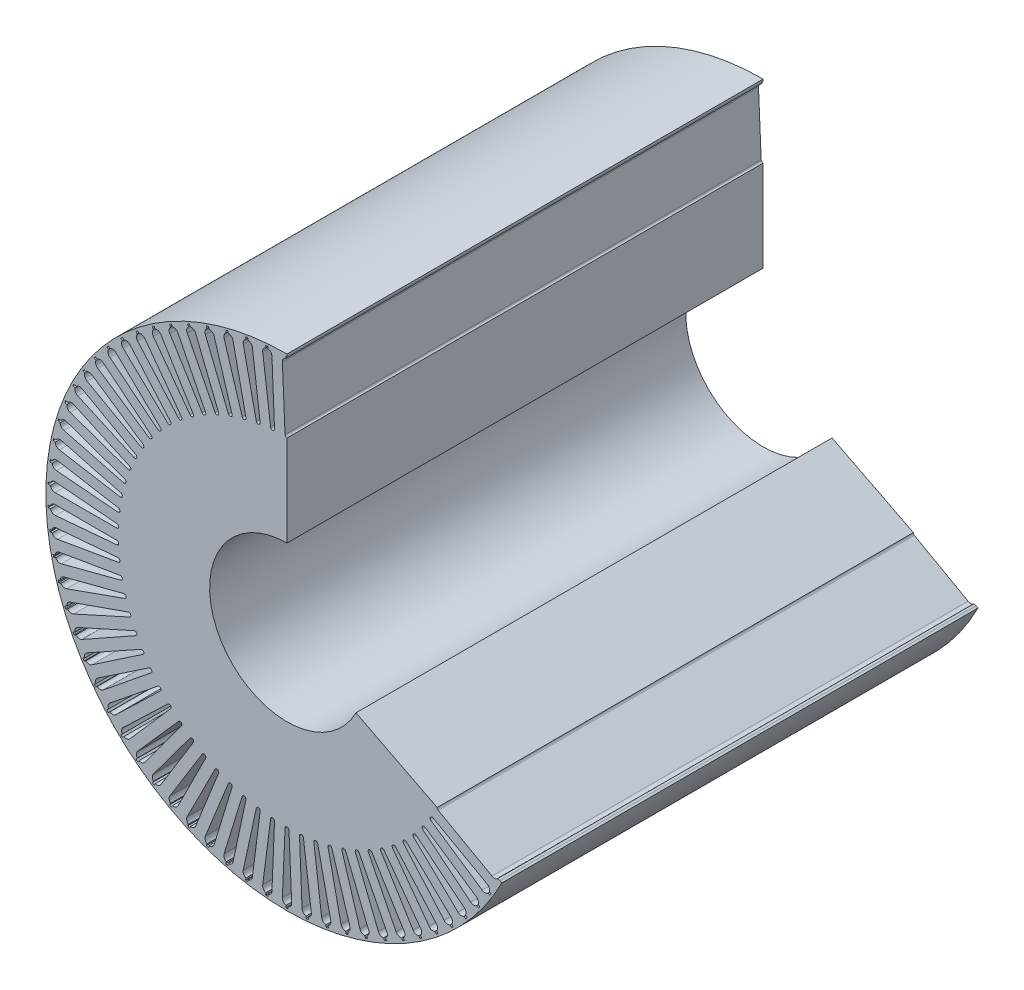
SolidWorks part; units mm, degrees
ref_plane "Přední rovina" through (0, 0, 0) normal (0, 0, 1) x (1, 0, 0)
ref_plane "Horní rovina" through (0, 0, 0) normal (0, 1, 0) x (1, 0, 0)
ref_plane "Pravá rovina" through (0, 0, 0) normal (1, 0, 0) x (0, 0, -1)
sketch "Skica1" plane through (0, 0, 0) normal (0, 0, 1) x (1, 0, 0)
  line L0 (0, 94.0554) -> (0, -97.5291) construction
  line L1 (-111.4898, 0) -> (131.9321, 0) construction
  line L2 (0, 77.9) -> (0, 77.2)
  line L3 (-0.35, 77.2) -> (0.35, 77.2)
  line L4 (0.35, 77.2) -> (0.35, 76.5)
  line L5 (0, 76.5) -> (0, 75.0365)
  line L6 (0, 75.0365) -> (0, 55.0346)
  line L7 (1.5047, 75.0365) -> (0.63, 55.0346)
  line L8 (-1.5047, 75.0365) -> (-0.63, 55.0346)
  line L9 (-0.35, 77.2) -> (-0.35, 76.5)
  line L10 (4.8642, 74.8938) -> (4.0395, 54.8898)
  line L11 (7.8629, 74.6386) -> (5.295, 54.7829)
  line L12 (6.8958, 76.8922) -> (6.8364, 76.1947)
  line L13 (6.1983, 76.9516) -> (6.1389, 76.2541)
  line L14 (6.1983, 76.9516) -> (6.8958, 76.8922)
  line L15 (11.1981, 74.2115) -> (8.68, 54.3495)
  line L16 (14.1643, 73.7029) -> (9.9218, 54.1365)
  line L17 (13.3918, 76.0304) -> (13.2735, 75.3405)
  line L18 (12.7019, 76.1487) -> (12.5836, 75.4588)
  line L19 (12.7019, 76.1487) -> (13.3918, 76.0304)
  line L20 (17.4514, 72.9945) -> (13.2578, 53.4176)
  line L21 (20.3637, 72.2362) -> (14.4772, 53.1001)
  line L22 (19.7914, 74.6208) -> (19.615, 73.9434)
  line L23 (19.114, 74.7972) -> (18.9376, 74.1198)
  line L24 (19.114, 74.7972) -> (19.7914, 74.6208)
  line L25 (23.5789, 71.2515) -> (17.7402, 52.1008)
  line L26 (26.4164, 70.249) -> (18.9282, 51.681)
  line L27 (26.0484, 72.6735) -> (25.8152, 72.0135)
  line L28 (25.3884, 72.9067) -> (25.1552, 72.2467)
  line L29 (25.3884, 72.9067) -> (26.0484, 72.6735)
  line L30 (29.5365, 68.9952) -> (22.0948, 50.4086)
  line L31 (32.2788, 67.7556) -> (23.2429, 49.8896)
  line L32 (32.1177, 70.2027) -> (31.8294, 69.5648)
  line L33 (31.4798, 70.491) -> (31.1915, 69.8531)
  line L34 (31.4798, 70.491) -> (32.1177, 70.2027)
  line L35 (35.2813, 66.2418) -> (26.2901, 48.3533)
  line L36 (37.9086, 64.7741) -> (27.3901, 47.7388)
  line L37 (37.9556, 67.226) -> (37.6142, 66.6149)
  line L38 (37.3445, 67.5674) -> (37.0031, 66.9563)
  line L39 (37.3445, 67.5674) -> (37.9556, 67.226)
  line L40 (40.7719, 63.0111) -> (30.296, 45.9495)
  line L41 (43.2653, 61.3259) -> (31.34, 45.2439)
  line L42 (43.52, 63.765) -> (43.128, 63.185)
  line L43 (42.9401, 64.1569) -> (42.5481, 63.577)
  line L44 (42.9401, 64.1569) -> (43.52, 63.765)
  line L45 (45.9687, 59.3264) -> (34.0837, 43.2147)
  line L46 (48.3102, 57.4358) -> (35.064, 42.4231)
  line L47 (48.7709, 59.8445) -> (48.3311, 59.2999)
  line L48 (48.2263, 60.2842) -> (47.7865, 59.7396)
  line L49 (48.2263, 60.2842) -> (48.7709, 59.8445)
  line L50 (50.8343, 55.2143) -> (37.6258, 40.1685)
  line L51 (53.007, 53.1319) -> (38.5354, 39.2967)
  line L52 (53.6704, 55.4928) -> (53.186, 54.9875)
  line L53 (53.165, 55.9772) -> (52.6806, 55.4718)
  line L54 (53.165, 55.9772) -> (53.6704, 55.4928)
  line L55 (55.3337, 50.7043) -> (40.8967, 36.8329)
  line L56 (57.322, 48.4452) -> (41.7292, 35.8871)
  line L57 (58.1831, 50.7414) -> (57.6577, 50.2789)
  line L58 (57.7207, 51.2668) -> (57.1952, 50.8044)
  line L59 (57.7207, 51.2668) -> (58.1831, 50.7414)
  line L60 (59.4344, 45.829) -> (43.8731, 33.2319)
  line L61 (61.2239, 43.4094) -> (44.6223, 32.2189)
  line L62 (62.2767, 45.6243) -> (61.7139, 45.208)
  line L63 (61.8605, 46.1871) -> (61.2977, 45.7708)
  line L64 (61.8605, 46.1871) -> (62.2767, 45.6243)
  line L65 (63.1068, 40.6235) -> (46.5333, 29.3915)
  line L66 (64.6847, 38.0609) -> (47.1939, 28.3186)
  line L67 (65.9216, 40.1785) -> (65.3255, 39.8115)
  line L68 (65.5545, 40.7746) -> (64.9585, 40.4075)
  line L69 (65.5545, 40.7746) -> (65.9216, 40.1785)
  line L70 (66.3246, 35.1253) -> (48.8582, 25.3393)
  line L71 (67.6795, 32.4381) -> (49.4255, 24.2143)
  line L72 (69.0914, 34.4432) -> (68.4664, 34.1281)
  line L73 (68.7763, 35.0683) -> (68.1513, 34.7531)
  line L74 (68.7763, 35.0683) -> (69.0914, 34.4432)
  line L75 (69.0645, 29.3741) -> (50.8311, 21.1046)
  line L76 (70.1866, 26.5816) -> (51.3009, 19.9354)
  line L77 (71.7635, 28.4598) -> (71.114, 28.1988)
  line L78 (71.5025, 29.1093) -> (70.853, 28.8483)
  line L79 (71.5025, 29.1093) -> (71.7635, 28.4598)
  line L80 (71.3068, 23.4112) -> (52.4378, 16.7178)
  line L81 (72.1881, 20.5336) -> (52.8068, 15.513)
  line L82 (73.9186, 22.2713) -> (73.2492, 22.0663)
  line L83 (73.7136, 22.9406) -> (73.0443, 22.7356)
  line L84 (73.7136, 22.9406) -> (73.9186, 22.2713)
  line L85 (73.0353, 17.2796) -> (53.6667, 12.2105)
  line L86 (73.6694, 14.3377) -> (53.9321, 10.9788)
  line L87 (75.541, 15.9223) -> (74.8567, 15.7748)
  line L88 (75.3935, 16.6066) -> (74.7092, 16.4591)
  line L89 (75.3935, 16.6066) -> (75.541, 15.9223)
  line L90 (74.2376, 11.0235) -> (54.5088, 7.6153)
  line L91 (74.6199, 8.0384) -> (54.6689, 6.3655)
  line L92 (76.6192, 9.4586) -> (75.9248, 9.3697)
  line L93 (76.5303, 10.1529) -> (75.8359, 10.064)
  line L94 (76.5303, 10.1529) -> (76.6192, 9.4586)
  line L95 (74.9051, 4.688) -> (54.9583, 2.9652)
  line L96 (75.0328, 1.6813) -> (55.0118, 1.7063)
  line L97 (77.1453, 2.9268) -> (76.4459, 2.8971)
  line L98 (77.1156, 3.6261) -> (76.4162, 3.5964)
  line L99 (77.1156, 3.6261) -> (77.1453, 2.9268)
  line L100 (75.0328, -1.6813) -> (55.0118, -1.7063)
  line L101 (74.9051, -4.688) -> (54.9583, -2.9652)
  line L102 (77.1156, -3.6261) -> (76.4162, -3.5964)
  line L103 (77.1453, -2.9268) -> (76.4459, -2.8971)
  line L104 (77.1453, -2.9268) -> (77.1156, -3.6261)
  line L105 (74.6199, -8.0384) -> (54.6689, -6.3655)
  line L106 (74.2376, -11.0235) -> (54.5088, -7.6153)
  line L107 (76.5303, -10.1529) -> (75.8359, -10.064)
  line L108 (76.6192, -9.4586) -> (75.9248, -9.3697)
  line L109 (76.6192, -9.4586) -> (76.5303, -10.1529)
  line L110 (73.6694, -14.3377) -> (53.9321, -10.9788)
  line L111 (73.0353, -17.2796) -> (53.6667, -12.2105)
  line L112 (75.3935, -16.6066) -> (74.7092, -16.4591)
  line L113 (75.541, -15.9223) -> (74.8567, -15.7748)
  line L114 (75.541, -15.9223) -> (75.3935, -16.6066)
  line L115 (72.1881, -20.5336) -> (52.8068, -15.513)
  line L116 (71.3068, -23.4112) -> (52.4378, -16.7178)
  line L117 (73.7136, -22.9406) -> (73.0443, -22.7356)
  line L118 (73.9186, -22.2713) -> (73.2492, -22.0663)
  line L119 (73.9186, -22.2713) -> (73.7136, -22.9406)
  line L120 (70.1866, -26.5816) -> (51.3009, -19.9354)
  line L121 (69.0645, -29.3741) -> (50.8311, -21.1046)
  line L122 (71.5025, -29.1093) -> (70.853, -28.8483)
  line L123 (71.7635, -28.4598) -> (71.114, -28.1988)
  line L124 (71.7635, -28.4598) -> (71.5025, -29.1093)
  line L125 (67.6795, -32.4381) -> (49.4255, -24.2143)
  line L126 (66.3246, -35.1253) -> (48.8582, -25.3393)
  line L127 (68.7763, -35.0683) -> (68.1513, -34.7531)
  line L128 (69.0914, -34.4432) -> (68.4664, -34.1281)
  line L129 (69.0914, -34.4432) -> (68.7763, -35.0683)
  line L130 (64.6847, -38.0609) -> (47.1939, -28.3186)
  line L131 (63.1068, -40.6235) -> (46.5333, -29.3915)
  line L132 (65.5545, -40.7746) -> (64.9585, -40.4075)
  line L133 (65.9216, -40.1785) -> (65.3255, -39.8115)
  line L134 (65.9216, -40.1785) -> (65.5545, -40.7746)
  line L135 (61.2239, -43.4094) -> (44.6223, -32.2189)
  line L136 (59.4344, -45.829) -> (43.8731, -33.2319)
  line L137 (61.8605, -46.1871) -> (61.2977, -45.7708)
  line L138 (62.2767, -45.6243) -> (61.7139, -45.208)
  line L139 (62.2767, -45.6243) -> (61.8605, -46.1871)
  line L140 (57.322, -48.4452) -> (41.7292, -35.8871)
  line L141 (55.3337, -50.7043) -> (40.8967, -36.8329)
  line L142 (57.7207, -51.2668) -> (57.1952, -50.8044)
  line L143 (58.1831, -50.7414) -> (57.6577, -50.2789)
  line L144 (58.1831, -50.7414) -> (57.7207, -51.2668)
  line L145 (53.007, -53.1319) -> (38.5354, -39.2967)
  line L146 (50.8343, -55.2143) -> (37.6258, -40.1685)
  line L147 (53.165, -55.9772) -> (52.6806, -55.4718)
  line L148 (53.6704, -55.4928) -> (53.186, -54.9875)
  line L149 (53.6704, -55.4928) -> (53.165, -55.9772)
  line L150 (48.3102, -57.4358) -> (35.064, -42.4231)
  line L151 (45.9687, -59.3264) -> (34.0837, -43.2147)
  line L152 (48.2263, -60.2842) -> (47.7865, -59.7396)
  line L153 (48.7709, -59.8445) -> (48.3311, -59.2999)
  line L154 (48.7709, -59.8445) -> (48.2263, -60.2842)
  line L155 (43.2653, -61.3259) -> (31.34, -45.2439)
  line L156 (40.7719, -63.0111) -> (30.296, -45.9495)
  line L157 (42.9401, -64.1569) -> (42.5481, -63.577)
  line L158 (43.52, -63.765) -> (43.128, -63.185)
  line L159 (43.52, -63.765) -> (42.9401, -64.1569)
  line L160 (37.9086, -64.7741) -> (27.3901, -47.7388)
  line L161 (35.2813, -66.2418) -> (26.2901, -48.3533)
  line L162 (37.3445, -67.5674) -> (37.0031, -66.9563)
  line L163 (37.9556, -67.226) -> (37.6142, -66.6149)
  line L164 (37.9556, -67.226) -> (37.3445, -67.5674)
  line L165 (32.2788, -67.7556) -> (23.2429, -49.8896)
  line L166 (29.5365, -68.9952) -> (22.0948, -50.4086)
  line L167 (31.4798, -70.491) -> (31.1915, -69.8531)
  line L168 (32.1177, -70.2027) -> (31.8294, -69.5648)
  line L169 (32.1177, -70.2027) -> (31.4798, -70.491)
  line L170 (26.4164, -70.249) -> (18.9282, -51.681)
  line L171 (23.5789, -71.2515) -> (17.7402, -52.1008)
  line L172 (25.3884, -72.9067) -> (25.1552, -72.2467)
  line L173 (26.0484, -72.6735) -> (25.8152, -72.0135)
  line L174 (26.0484, -72.6735) -> (25.3884, -72.9067)
  line L175 (20.3637, -72.2362) -> (14.4772, -53.1001)
  line L176 (17.4514, -72.9945) -> (13.2578, -53.4176)
  line L177 (19.114, -74.7972) -> (18.9376, -74.1198)
  line L178 (19.7914, -74.6208) -> (19.615, -73.9434)
  line L179 (19.7914, -74.6208) -> (19.114, -74.7972)
  line L180 (14.1643, -73.7029) -> (9.9218, -54.1365)
  line L181 (11.1981, -74.2115) -> (8.68, -54.3495)
  line L182 (12.7019, -76.1487) -> (12.5836, -75.4588)
  line L183 (13.3918, -76.0304) -> (13.2735, -75.3405)
  line L184 (13.3918, -76.0304) -> (12.7019, -76.1487)
  line L185 (7.8629, -74.6386) -> (5.295, -54.7829)
  line L186 (4.8642, -74.8938) -> (4.0395, -54.8898)
  line L187 (6.1983, -76.9516) -> (6.1389, -76.2541)
  line L188 (6.8958, -76.8922) -> (6.8364, -76.1947)
  line L189 (6.8958, -76.8922) -> (6.1983, -76.9516)
  line L190 (1.5047, -75.0365) -> (0.63, -55.0346)
  line L191 (-1.5047, -75.0365) -> (-0.63, -55.0346)
  line L192 (-0.35, -77.2) -> (-0.35, -76.5)
  line L193 (0.35, -77.2) -> (0.35, -76.5)
  line L194 (0.35, -77.2) -> (-0.35, -77.2)
  line L195 (-4.8642, -74.8938) -> (-4.0395, -54.8898)
  line L196 (-7.8629, -74.6386) -> (-5.295, -54.7829)
  line L197 (-6.8958, -76.8922) -> (-6.8364, -76.1947)
  line L198 (-6.1983, -76.9516) -> (-6.1389, -76.2541)
  line L199 (-6.1983, -76.9516) -> (-6.8958, -76.8922)
  line L200 (-11.1981, -74.2115) -> (-8.68, -54.3495)
  line L201 (-14.1643, -73.7029) -> (-9.9218, -54.1365)
  line L202 (-13.3918, -76.0304) -> (-13.2735, -75.3405)
  line L203 (-12.7019, -76.1487) -> (-12.5836, -75.4588)
  line L204 (-12.7019, -76.1487) -> (-13.3918, -76.0304)
  line L205 (-17.4514, -72.9945) -> (-13.2578, -53.4176)
  line L206 (-20.3637, -72.2362) -> (-14.4772, -53.1001)
  line L207 (-19.7914, -74.6208) -> (-19.615, -73.9434)
  line L208 (-19.114, -74.7972) -> (-18.9376, -74.1198)
  line L209 (-19.114, -74.7972) -> (-19.7914, -74.6208)
  line L210 (-23.5789, -71.2515) -> (-17.7402, -52.1008)
  line L211 (-26.4164, -70.249) -> (-18.9282, -51.681)
  line L212 (-26.0484, -72.6735) -> (-25.8152, -72.0135)
  line L213 (-25.3884, -72.9067) -> (-25.1552, -72.2467)
  line L214 (-25.3884, -72.9067) -> (-26.0484, -72.6735)
  line L215 (-29.5365, -68.9952) -> (-22.0948, -50.4086)
  line L216 (-32.2788, -67.7556) -> (-23.2429, -49.8896)
  line L217 (-32.1177, -70.2027) -> (-31.8294, -69.5648)
  line L218 (-31.4798, -70.491) -> (-31.1915, -69.8531)
  line L219 (-31.4798, -70.491) -> (-32.1177, -70.2027)
  line L220 (-35.2813, -66.2418) -> (-26.2901, -48.3533)
  line L221 (-37.9086, -64.7741) -> (-27.3901, -47.7388)
  line L222 (-37.9556, -67.226) -> (-37.6142, -66.6149)
  line L223 (-37.3445, -67.5674) -> (-37.0031, -66.9563)
  line L224 (-37.3445, -67.5674) -> (-37.9556, -67.226)
  line L225 (-40.7719, -63.0111) -> (-30.296, -45.9495)
  line L226 (-43.2653, -61.3259) -> (-31.34, -45.2439)
  line L227 (-43.52, -63.765) -> (-43.128, -63.185)
  line L228 (-42.9401, -64.1569) -> (-42.5481, -63.577)
  line L229 (-42.9401, -64.1569) -> (-43.52, -63.765)
  line L230 (-45.9687, -59.3264) -> (-34.0837, -43.2147)
  line L231 (-48.3102, -57.4358) -> (-35.064, -42.4231)
  line L232 (-48.7709, -59.8445) -> (-48.3311, -59.2999)
  line L233 (-48.2263, -60.2842) -> (-47.7865, -59.7396)
  line L234 (-48.2263, -60.2842) -> (-48.7709, -59.8445)
  line L235 (-50.8343, -55.2143) -> (-37.6258, -40.1685)
  line L236 (-53.007, -53.1319) -> (-38.5354, -39.2967)
  line L237 (-53.6704, -55.4928) -> (-53.186, -54.9875)
  line L238 (-53.165, -55.9772) -> (-52.6806, -55.4718)
  line L239 (-53.165, -55.9772) -> (-53.6704, -55.4928)
  line L240 (-55.3337, -50.7043) -> (-40.8967, -36.8329)
  line L241 (-57.322, -48.4452) -> (-41.7292, -35.8871)
  line L242 (-58.1831, -50.7414) -> (-57.6577, -50.2789)
  line L243 (-57.7207, -51.2668) -> (-57.1952, -50.8044)
  line L244 (-57.7207, -51.2668) -> (-58.1831, -50.7414)
  line L245 (-59.4344, -45.829) -> (-43.8731, -33.2319)
  line L246 (-61.2239, -43.4094) -> (-44.6223, -32.2189)
  line L247 (-62.2767, -45.6243) -> (-61.7139, -45.208)
  line L248 (-61.8605, -46.1871) -> (-61.2977, -45.7708)
  line L249 (-61.8605, -46.1871) -> (-62.2767, -45.6243)
  line L250 (-63.1068, -40.6235) -> (-46.5333, -29.3915)
  line L251 (-64.6847, -38.0609) -> (-47.1939, -28.3186)
  line L252 (-65.9216, -40.1785) -> (-65.3255, -39.8115)
  line L253 (-65.5545, -40.7746) -> (-64.9585, -40.4075)
  line L254 (-65.5545, -40.7746) -> (-65.9216, -40.1785)
  line L255 (-66.3246, -35.1253) -> (-48.8582, -25.3393)
  line L256 (-67.6795, -32.4381) -> (-49.4255, -24.2143)
  line L257 (-69.0914, -34.4432) -> (-68.4664, -34.1281)
  line L258 (-68.7763, -35.0683) -> (-68.1513, -34.7531)
  line L259 (-68.7763, -35.0683) -> (-69.0914, -34.4432)
  line L260 (-69.0645, -29.3741) -> (-50.8311, -21.1046)
  line L261 (-70.1866, -26.5816) -> (-51.3009, -19.9354)
  line L262 (-71.7635, -28.4598) -> (-71.114, -28.1988)
  line L263 (-71.5025, -29.1093) -> (-70.853, -28.8483)
  line L264 (-71.5025, -29.1093) -> (-71.7635, -28.4598)
  line L265 (-71.3068, -23.4112) -> (-52.4378, -16.7178)
  line L266 (-72.1881, -20.5336) -> (-52.8068, -15.513)
  line L267 (-73.9186, -22.2713) -> (-73.2492, -22.0663)
  line L268 (-73.7136, -22.9406) -> (-73.0443, -22.7356)
  line L269 (-73.7136, -22.9406) -> (-73.9186, -22.2713)
  line L270 (-73.0353, -17.2796) -> (-53.6667, -12.2105)
  line L271 (-73.6694, -14.3377) -> (-53.9321, -10.9788)
  line L272 (-75.541, -15.9223) -> (-74.8567, -15.7748)
  line L273 (-75.3935, -16.6066) -> (-74.7092, -16.4591)
  line L274 (-75.3935, -16.6066) -> (-75.541, -15.9223)
  line L275 (-74.2376, -11.0235) -> (-54.5088, -7.6153)
  line L276 (-74.6199, -8.0384) -> (-54.6689, -6.3655)
  line L277 (-76.6192, -9.4586) -> (-75.9248, -9.3697)
  line L278 (-76.5303, -10.1529) -> (-75.8359, -10.064)
  line L279 (-76.5303, -10.1529) -> (-76.6192, -9.4586)
  line L280 (-74.9051, -4.688) -> (-54.9583, -2.9652)
  line L281 (-75.0328, -1.6813) -> (-55.0118, -1.7063)
  line L282 (-77.1453, -2.9268) -> (-76.4459, -2.8971)
  line L283 (-77.1156, -3.6261) -> (-76.4162, -3.5964)
  line L284 (-77.1156, -3.6261) -> (-77.1453, -2.9268)
  line L285 (-75.0328, 1.6813) -> (-55.0118, 1.7063)
  line L286 (-74.9051, 4.688) -> (-54.9583, 2.9652)
  line L287 (-77.1156, 3.6261) -> (-76.4162, 3.5964)
  line L288 (-77.1453, 2.9268) -> (-76.4459, 2.8971)
  line L289 (-77.1453, 2.9268) -> (-77.1156, 3.6261)
  line L290 (-74.6199, 8.0384) -> (-54.6689, 6.3655)
  line L291 (-74.2376, 11.0235) -> (-54.5088, 7.6153)
  line L292 (-76.5303, 10.1529) -> (-75.8359, 10.064)
  line L293 (-76.6192, 9.4586) -> (-75.9248, 9.3697)
  line L294 (-76.6192, 9.4586) -> (-76.5303, 10.1529)
  line L295 (-73.6694, 14.3377) -> (-53.9321, 10.9788)
  line L296 (-73.0353, 17.2796) -> (-53.6667, 12.2105)
  line L297 (-75.3935, 16.6066) -> (-74.7092, 16.4591)
  line L298 (-75.541, 15.9223) -> (-74.8567, 15.7748)
  line L299 (-75.541, 15.9223) -> (-75.3935, 16.6066)
  line L300 (-72.1881, 20.5336) -> (-52.8068, 15.513)
  line L301 (-71.3068, 23.4112) -> (-52.4378, 16.7178)
  line L302 (-73.7136, 22.9406) -> (-73.0443, 22.7356)
  line L303 (-73.9186, 22.2713) -> (-73.2492, 22.0663)
  line L304 (-73.9186, 22.2713) -> (-73.7136, 22.9406)
  line L305 (-70.1866, 26.5816) -> (-51.3009, 19.9354)
  line L306 (-69.0645, 29.3741) -> (-50.8311, 21.1046)
  line L307 (-71.5025, 29.1093) -> (-70.853, 28.8483)
  line L308 (-71.7635, 28.4598) -> (-71.114, 28.1988)
  line L309 (-71.7635, 28.4598) -> (-71.5025, 29.1093)
  line L310 (-67.6795, 32.4381) -> (-49.4255, 24.2143)
  line L311 (-66.3246, 35.1253) -> (-48.8582, 25.3393)
  line L312 (-68.7763, 35.0683) -> (-68.1513, 34.7531)
  line L313 (-69.0914, 34.4432) -> (-68.4664, 34.1281)
  line L314 (-69.0914, 34.4432) -> (-68.7763, 35.0683)
  line L315 (-64.6847, 38.0609) -> (-47.1939, 28.3186)
  line L316 (-63.1068, 40.6235) -> (-46.5333, 29.3915)
  line L317 (-65.5545, 40.7746) -> (-64.9585, 40.4075)
  line L318 (-65.9216, 40.1785) -> (-65.3255, 39.8115)
  line L319 (-65.9216, 40.1785) -> (-65.5545, 40.7746)
  line L320 (-61.2239, 43.4094) -> (-44.6223, 32.2189)
  line L321 (-59.4344, 45.829) -> (-43.8731, 33.2319)
  line L322 (-61.8605, 46.1871) -> (-61.2977, 45.7708)
  line L323 (-62.2767, 45.6243) -> (-61.7139, 45.208)
  line L324 (-62.2767, 45.6243) -> (-61.8605, 46.1871)
  line L325 (-57.322, 48.4452) -> (-41.7292, 35.8871)
  line L326 (-55.3337, 50.7043) -> (-40.8967, 36.8329)
  line L327 (-57.7207, 51.2668) -> (-57.1952, 50.8044)
  line L328 (-58.1831, 50.7414) -> (-57.6577, 50.2789)
  line L329 (-58.1831, 50.7414) -> (-57.7207, 51.2668)
  line L330 (-53.007, 53.1319) -> (-38.5354, 39.2967)
  line L331 (-50.8343, 55.2143) -> (-37.6258, 40.1685)
  line L332 (-53.165, 55.9772) -> (-52.6806, 55.4718)
  line L333 (-53.6704, 55.4928) -> (-53.186, 54.9875)
  line L334 (-53.6704, 55.4928) -> (-53.165, 55.9772)
  line L335 (-48.3102, 57.4358) -> (-35.064, 42.4231)
  line L336 (-45.9687, 59.3264) -> (-34.0837, 43.2147)
  line L337 (-48.2263, 60.2842) -> (-47.7865, 59.7396)
  line L338 (-48.7709, 59.8445) -> (-48.3311, 59.2999)
  line L339 (-48.7709, 59.8445) -> (-48.2263, 60.2842)
  line L340 (-43.2653, 61.3259) -> (-31.34, 45.2439)
  line L341 (-40.7719, 63.0111) -> (-30.296, 45.9495)
  line L342 (-42.9401, 64.1569) -> (-42.5481, 63.577)
  line L343 (-43.52, 63.765) -> (-43.128, 63.185)
  line L344 (-43.52, 63.765) -> (-42.9401, 64.1569)
  line L345 (-37.9086, 64.7741) -> (-27.3901, 47.7388)
  line L346 (-35.2813, 66.2418) -> (-26.2901, 48.3533)
  line L347 (-37.3445, 67.5674) -> (-37.0031, 66.9563)
  line L348 (-37.9556, 67.226) -> (-37.6142, 66.6149)
  line L349 (-37.9556, 67.226) -> (-37.3445, 67.5674)
  line L350 (-32.2788, 67.7556) -> (-23.2429, 49.8896)
  line L351 (-29.5365, 68.9952) -> (-22.0948, 50.4086)
  line L352 (-31.4798, 70.491) -> (-31.1915, 69.8531)
  line L353 (-32.1177, 70.2027) -> (-31.8294, 69.5648)
  line L354 (-32.1177, 70.2027) -> (-31.4798, 70.491)
  line L355 (-26.4164, 70.249) -> (-18.9282, 51.681)
  line L356 (-23.5789, 71.2515) -> (-17.7402, 52.1008)
  line L357 (-25.3884, 72.9067) -> (-25.1552, 72.2467)
  line L358 (-26.0484, 72.6735) -> (-25.8152, 72.0135)
  line L359 (-26.0484, 72.6735) -> (-25.3884, 72.9067)
  line L360 (-20.3637, 72.2362) -> (-14.4772, 53.1001)
  line L361 (-17.4514, 72.9945) -> (-13.2578, 53.4176)
  line L362 (-19.114, 74.7972) -> (-18.9376, 74.1198)
  line L363 (-19.7914, 74.6208) -> (-19.615, 73.9434)
  line L364 (-19.7914, 74.6208) -> (-19.114, 74.7972)
  line L365 (-14.1643, 73.7029) -> (-9.9218, 54.1365)
  line L366 (-11.1981, 74.2115) -> (-8.68, 54.3495)
  line L367 (-12.7019, 76.1487) -> (-12.5836, 75.4588)
  line L368 (-13.3918, 76.0304) -> (-13.2735, 75.3405)
  line L369 (-13.3918, 76.0304) -> (-12.7019, 76.1487)
  line L370 (-7.8629, 74.6386) -> (-5.295, 54.7829)
  line L371 (-4.8642, 74.8938) -> (-4.0395, 54.8898)
  line L372 (-6.1983, 76.9516) -> (-6.1389, 76.2541)
  line L373 (-6.8958, 76.8922) -> (-6.8364, 76.1947)
  line L374 (-6.8958, 76.8922) -> (-6.1983, 76.9516)
  circle A0 centre (0, 0) radius 25
  circle A1 centre (0, 0) radius 77.9
  arc A2 (1.499, 74.9052) -> (0.35, 76.5) centre (0, 75.0365) ccw
  arc A3 (-0.63, 55.0346) -> (0.63, 55.0346) centre (0, 55.0346) ccw
  arc A4 (-0.35, 76.5) -> (-1.499, 74.9052) centre (0, 75.0365) ccw
  arc A5 (4.0395, 54.8898) -> (5.295, 54.7829) centre (4.6673, 54.8364) ccw
  arc A6 (6.1389, 76.2541) -> (4.8588, 74.7624) centre (6.3635, 74.7662) ccw
  arc A7 (7.846, 74.5082) -> (6.8364, 76.1947) centre (6.3635, 74.7662) ccw
  arc A8 (8.68, 54.3495) -> (9.9218, 54.1365) centre (9.3009, 54.243) ccw
  arc A9 (12.5836, 75.4588) -> (11.1816, 74.0811) centre (12.6812, 73.9572) ccw
  arc A10 (14.1365, 73.5744) -> (13.2735, 75.3405) centre (12.6812, 73.9572) ccw
  arc A11 (13.2578, 53.4176) -> (14.4772, 53.1001) centre (13.8675, 53.2588) ccw
  arc A12 (18.9376, 74.1198) -> (17.4238, 72.8659) centre (18.9076, 72.6153) ccw
  arc A13 (20.3251, 72.1105) -> (19.615, 73.9434) centre (18.9076, 72.6153) ccw
  arc A14 (17.7402, 52.1008) -> (18.9282, 51.681) centre (18.3342, 51.8909) ccw
  arc A15 (25.1552, 72.2467) -> (23.5405, 71.1258) centre (24.9977, 70.7503) ccw
  arc A16 (26.3673, 70.127) -> (25.8152, 72.0135) centre (24.9977, 70.7503) ccw
  arc A17 (22.0948, 50.4086) -> (23.2429, 49.8896) centre (22.6688, 50.1491) ccw
  arc A18 (31.1915, 69.8531) -> (29.4876, 68.8732) centre (30.9076, 68.3754) ccw
  arc A19 (32.2195, 67.6383) -> (31.8294, 69.5648) centre (30.9076, 68.3754) ccw
  arc A20 (26.2901, 48.3533) -> (27.3901, 47.7388) centre (26.8401, 48.046) ccw
  arc A21 (37.0031, 66.9563) -> (35.2222, 66.1243) centre (36.5949, 65.508) ccw
  arc A22 (37.8395, 64.6622) -> (37.6142, 66.6149) centre (36.5949, 65.508) ccw
  arc A23 (30.296, 45.9495) -> (31.34, 45.2439) centre (30.818, 45.5967) ccw
  arc A24 (42.5481, 63.577) -> (40.7031, 62.8991) centre (42.0186, 62.1685) ccw
  arc A25 (43.1869, 61.2203) -> (43.128, 63.185) centre (42.0186, 62.1685) ccw
  arc A26 (34.0837, 43.2147) -> (35.064, 42.4231) centre (34.5739, 42.8189) ccw
  arc A27 (47.7865, 59.7396) -> (45.8907, 59.2206) centre (47.1394, 58.3811) ccw
  arc A28 (48.2232, 57.3372) -> (48.3311, 59.2999) centre (47.1394, 58.3811) ccw
  arc A29 (37.6258, 40.1685) -> (38.5354, 39.2967) centre (38.0806, 39.7326) ccw
  arc A30 (52.6806, 55.4718) -> (50.7476, 55.1155) centre (51.9207, 54.1731) ccw
  arc A31 (52.912, 53.041) -> (53.186, 54.9875) centre (51.9207, 54.1731) ccw
  arc A32 (40.8967, 36.8329) -> (41.7292, 35.8871) centre (41.313, 36.36) ccw
  arc A33 (57.1952, 50.8044) -> (55.2389, 50.6132) centre (56.3278, 49.5747) ccw
  arc A34 (57.2196, 48.3627) -> (57.6577, 50.2789) centre (56.3278, 49.5747) ccw
  arc A35 (43.8731, 33.2319) -> (44.6223, 32.2189) centre (44.2477, 32.7254) ccw
  arc A36 (61.2977, 45.7708) -> (59.3322, 45.7463) centre (60.3292, 44.6192) ccw
  arc A37 (61.1149, 43.3359) -> (61.7139, 45.208) centre (60.3292, 44.6192) ccw
  arc A38 (46.5333, 29.3915) -> (47.1939, 28.3186) centre (46.8636, 28.8551) ccw
  arc A39 (64.9585, 40.4075) -> (62.998, 40.5498) centre (63.8958, 39.3422) ccw
  arc A40 (64.5699, 37.9969) -> (65.3255, 39.8115) centre (63.8958, 39.3422) ccw
  arc A41 (48.8582, 25.3393) -> (49.4255, 24.2143) centre (49.1418, 24.7768) ccw
  arc A42 (68.1513, 34.7531) -> (66.2099, 35.0611) centre (67.0021, 33.7817) ccw
  arc A43 (67.5596, 32.3841) -> (68.4664, 34.1281) centre (67.0021, 33.7817) ccw
  arc A44 (50.8311, 21.1046) -> (51.3009, 19.9354) centre (51.066, 20.52) ccw
  arc A45 (70.853, 28.8483) -> (68.9448, 29.3198) centre (69.6256, 27.9779) ccw
  arc A46 (70.0626, 26.538) -> (71.114, 28.1988) centre (69.6256, 27.9779) ccw
  arc A47 (52.4378, 16.7178) -> (52.8068, 15.513) centre (52.6223, 16.1154) ccw
  arc A48 (73.0443, 22.7356) -> (71.1829, 23.3672) centre (71.7474, 21.9724) ccw
  arc A49 (72.0608, 20.5007) -> (73.2492, 22.0663) centre (71.7474, 21.9724) ccw
  arc A50 (53.6667, 12.2105) -> (53.9321, 10.9788) centre (53.7994, 11.5947) ccw
  arc A51 (74.7092, 16.4591) -> (72.9081, 17.2463) centre (73.3524, 15.8086) ccw
  arc A52 (73.5397, 14.3156) -> (74.8567, 15.7748) centre (73.3524, 15.8086) ccw
  arc A53 (54.5088, 7.6153) -> (54.6689, 6.3655) centre (54.5889, 6.9904) ccw
  arc A54 (75.8359, 10.064) -> (74.1081, 11.0011) centre (74.4288, 9.531) ccw
  arc A55 (74.4889, 8.0274) -> (75.9248, 9.3697) centre (74.4288, 9.531) ccw
  arc A56 (54.9583, 2.9652) -> (55.0118, 1.7063) centre (54.985, 2.3357) ccw
  arc A57 (76.4162, 3.5964) -> (74.7741, 4.6767) centre (74.9689, 3.1846) ccw
  arc A58 (74.9013, 1.6814) -> (76.4459, 2.8971) centre (74.9689, 3.1846) ccw
  arc A59 (55.0118, -1.7063) -> (54.9583, -2.9652) centre (54.985, -2.3357) ccw
  arc A60 (76.4459, -2.8971) -> (74.9013, -1.6814) centre (74.9689, -3.1846) ccw
  arc A61 (74.7741, -4.6767) -> (76.4162, -3.5964) centre (74.9689, -3.1846) ccw
  arc A62 (54.6689, -6.3655) -> (54.5088, -7.6153) centre (54.5889, -6.9904) ccw
  arc A63 (75.9248, -9.3697) -> (74.4889, -8.0274) centre (74.4288, -9.531) ccw
  arc A64 (74.1081, -11.0011) -> (75.8359, -10.064) centre (74.4288, -9.531) ccw
  arc A65 (53.9321, -10.9788) -> (53.6667, -12.2105) centre (53.7994, -11.5947) ccw
  arc A66 (74.8567, -15.7748) -> (73.5397, -14.3156) centre (73.3524, -15.8086) ccw
  arc A67 (72.9081, -17.2463) -> (74.7092, -16.4591) centre (73.3524, -15.8086) ccw
  arc A68 (52.8068, -15.513) -> (52.4378, -16.7178) centre (52.6223, -16.1154) ccw
  arc A69 (73.2492, -22.0663) -> (72.0608, -20.5007) centre (71.7474, -21.9724) ccw
  arc A70 (71.1829, -23.3672) -> (73.0443, -22.7356) centre (71.7474, -21.9724) ccw
  arc A71 (51.3009, -19.9354) -> (50.8311, -21.1046) centre (51.066, -20.52) ccw
  arc A72 (71.114, -28.1988) -> (70.0626, -26.538) centre (69.6256, -27.9779) ccw
  arc A73 (68.9448, -29.3198) -> (70.853, -28.8483) centre (69.6256, -27.9779) ccw
  arc A74 (49.4255, -24.2143) -> (48.8582, -25.3393) centre (49.1418, -24.7768) ccw
  arc A75 (68.4664, -34.1281) -> (67.5596, -32.3841) centre (67.0021, -33.7817) ccw
  arc A76 (66.2099, -35.0611) -> (68.1513, -34.7531) centre (67.0021, -33.7817) ccw
  arc A77 (47.1939, -28.3186) -> (46.5333, -29.3915) centre (46.8636, -28.8551) ccw
  arc A78 (65.3255, -39.8115) -> (64.5699, -37.9969) centre (63.8958, -39.3422) ccw
  arc A79 (62.998, -40.5498) -> (64.9585, -40.4075) centre (63.8958, -39.3422) ccw
  arc A80 (44.6223, -32.2189) -> (43.8731, -33.2319) centre (44.2477, -32.7254) ccw
  arc A81 (61.7139, -45.208) -> (61.1149, -43.3359) centre (60.3292, -44.6192) ccw
  arc A82 (59.3322, -45.7463) -> (61.2977, -45.7708) centre (60.3292, -44.6192) ccw
  arc A83 (41.7292, -35.8871) -> (40.8967, -36.8329) centre (41.313, -36.36) ccw
  arc A84 (57.6577, -50.2789) -> (57.2196, -48.3627) centre (56.3278, -49.5747) ccw
  arc A85 (55.2389, -50.6132) -> (57.1952, -50.8044) centre (56.3278, -49.5747) ccw
  arc A86 (38.5354, -39.2967) -> (37.6258, -40.1685) centre (38.0806, -39.7326) ccw
  arc A87 (53.186, -54.9875) -> (52.912, -53.041) centre (51.9207, -54.1731) ccw
  arc A88 (50.7476, -55.1155) -> (52.6806, -55.4718) centre (51.9207, -54.1731) ccw
  arc A89 (35.064, -42.4231) -> (34.0837, -43.2147) centre (34.5739, -42.8189) ccw
  arc A90 (48.3311, -59.2999) -> (48.2232, -57.3372) centre (47.1394, -58.3811) ccw
  arc A91 (45.8907, -59.2206) -> (47.7865, -59.7396) centre (47.1394, -58.3811) ccw
  arc A92 (31.34, -45.2439) -> (30.296, -45.9495) centre (30.818, -45.5967) ccw
  arc A93 (43.128, -63.185) -> (43.1869, -61.2203) centre (42.0186, -62.1685) ccw
  arc A94 (40.7031, -62.8991) -> (42.5481, -63.577) centre (42.0186, -62.1685) ccw
  arc A95 (27.3901, -47.7388) -> (26.2901, -48.3533) centre (26.8401, -48.046) ccw
  arc A96 (37.6142, -66.6149) -> (37.8395, -64.6622) centre (36.5949, -65.508) ccw
  arc A97 (35.2222, -66.1243) -> (37.0031, -66.9563) centre (36.5949, -65.508) ccw
  arc A98 (23.2429, -49.8896) -> (22.0948, -50.4086) centre (22.6688, -50.1491) ccw
  arc A99 (31.8294, -69.5648) -> (32.2195, -67.6383) centre (30.9076, -68.3754) ccw
  arc A100 (29.4876, -68.8732) -> (31.1915, -69.8531) centre (30.9076, -68.3754) ccw
  arc A101 (18.9282, -51.681) -> (17.7402, -52.1008) centre (18.3342, -51.8909) ccw
  arc A102 (25.8152, -72.0135) -> (26.3673, -70.127) centre (24.9977, -70.7503) ccw
  arc A103 (23.5405, -71.1258) -> (25.1552, -72.2467) centre (24.9977, -70.7503) ccw
  arc A104 (14.4772, -53.1001) -> (13.2578, -53.4176) centre (13.8675, -53.2588) ccw
  arc A105 (19.615, -73.9434) -> (20.3251, -72.1105) centre (18.9076, -72.6153) ccw
  arc A106 (17.4238, -72.8659) -> (18.9376, -74.1198) centre (18.9076, -72.6153) ccw
  arc A107 (9.9218, -54.1365) -> (8.68, -54.3495) centre (9.3009, -54.243) ccw
  arc A108 (13.2735, -75.3405) -> (14.1365, -73.5744) centre (12.6812, -73.9572) ccw
  arc A109 (11.1816, -74.0811) -> (12.5836, -75.4588) centre (12.6812, -73.9572) ccw
  arc A110 (5.295, -54.7829) -> (4.0395, -54.8898) centre (4.6673, -54.8364) ccw
  arc A111 (6.8364, -76.1947) -> (7.846, -74.5082) centre (6.3635, -74.7662) ccw
  arc A112 (4.8588, -74.7624) -> (6.1389, -76.2541) centre (6.3635, -74.7662) ccw
  arc A113 (0.63, -55.0346) -> (-0.63, -55.0346) centre (0, -55.0346) ccw
  arc A114 (0.35, -76.5) -> (1.499, -74.9052) centre (0, -75.0365) ccw
  arc A115 (-1.499, -74.9052) -> (-0.35, -76.5) centre (0, -75.0365) ccw
  arc A116 (-4.0395, -54.8898) -> (-5.295, -54.7829) centre (-4.6673, -54.8364) ccw
  arc A117 (-6.1389, -76.2541) -> (-4.8588, -74.7624) centre (-6.3635, -74.7662) ccw
  arc A118 (-7.846, -74.5082) -> (-6.8364, -76.1947) centre (-6.3635, -74.7662) ccw
  arc A119 (-8.68, -54.3495) -> (-9.9218, -54.1365) centre (-9.3009, -54.243) ccw
  arc A120 (-12.5836, -75.4588) -> (-11.1816, -74.0811) centre (-12.6812, -73.9572) ccw
  arc A121 (-14.1365, -73.5744) -> (-13.2735, -75.3405) centre (-12.6812, -73.9572) ccw
  arc A122 (-13.2578, -53.4176) -> (-14.4772, -53.1001) centre (-13.8675, -53.2588) ccw
  arc A123 (-18.9376, -74.1198) -> (-17.4238, -72.8659) centre (-18.9076, -72.6153) ccw
  arc A124 (-20.3251, -72.1105) -> (-19.615, -73.9434) centre (-18.9076, -72.6153) ccw
  arc A125 (-17.7402, -52.1008) -> (-18.9282, -51.681) centre (-18.3342, -51.8909) ccw
  arc A126 (-25.1552, -72.2467) -> (-23.5405, -71.1258) centre (-24.9977, -70.7503) ccw
  arc A127 (-26.3673, -70.127) -> (-25.8152, -72.0135) centre (-24.9977, -70.7503) ccw
  arc A128 (-22.0948, -50.4086) -> (-23.2429, -49.8896) centre (-22.6688, -50.1491) ccw
  arc A129 (-31.1915, -69.8531) -> (-29.4876, -68.8732) centre (-30.9076, -68.3754) ccw
  arc A130 (-32.2195, -67.6383) -> (-31.8294, -69.5648) centre (-30.9076, -68.3754) ccw
  arc A131 (-26.2901, -48.3533) -> (-27.3901, -47.7388) centre (-26.8401, -48.046) ccw
  arc A132 (-37.0031, -66.9563) -> (-35.2222, -66.1243) centre (-36.5949, -65.508) ccw
  arc A133 (-37.8395, -64.6622) -> (-37.6142, -66.6149) centre (-36.5949, -65.508) ccw
  arc A134 (-30.296, -45.9495) -> (-31.34, -45.2439) centre (-30.818, -45.5967) ccw
  arc A135 (-42.5481, -63.577) -> (-40.7031, -62.8991) centre (-42.0186, -62.1685) ccw
  arc A136 (-43.1869, -61.2203) -> (-43.128, -63.185) centre (-42.0186, -62.1685) ccw
  arc A137 (-34.0837, -43.2147) -> (-35.064, -42.4231) centre (-34.5739, -42.8189) ccw
  arc A138 (-47.7865, -59.7396) -> (-45.8907, -59.2206) centre (-47.1394, -58.3811) ccw
  arc A139 (-48.2232, -57.3372) -> (-48.3311, -59.2999) centre (-47.1394, -58.3811) ccw
  arc A140 (-37.6258, -40.1685) -> (-38.5354, -39.2967) centre (-38.0806, -39.7326) ccw
  arc A141 (-52.6806, -55.4718) -> (-50.7476, -55.1155) centre (-51.9207, -54.1731) ccw
  arc A142 (-52.912, -53.041) -> (-53.186, -54.9875) centre (-51.9207, -54.1731) ccw
  arc A143 (-40.8967, -36.8329) -> (-41.7292, -35.8871) centre (-41.313, -36.36) ccw
  arc A144 (-57.1952, -50.8044) -> (-55.2389, -50.6132) centre (-56.3278, -49.5747) ccw
  arc A145 (-57.2196, -48.3627) -> (-57.6577, -50.2789) centre (-56.3278, -49.5747) ccw
  arc A146 (-43.8731, -33.2319) -> (-44.6223, -32.2189) centre (-44.2477, -32.7254) ccw
  arc A147 (-61.2977, -45.7708) -> (-59.3322, -45.7463) centre (-60.3292, -44.6192) ccw
  arc A148 (-61.1149, -43.3359) -> (-61.7139, -45.208) centre (-60.3292, -44.6192) ccw
  arc A149 (-46.5333, -29.3915) -> (-47.1939, -28.3186) centre (-46.8636, -28.8551) ccw
  arc A150 (-64.9585, -40.4075) -> (-62.998, -40.5498) centre (-63.8958, -39.3422) ccw
  arc A151 (-64.5699, -37.9969) -> (-65.3255, -39.8115) centre (-63.8958, -39.3422) ccw
  arc A152 (-48.8582, -25.3393) -> (-49.4255, -24.2143) centre (-49.1418, -24.7768) ccw
  arc A153 (-68.1513, -34.7531) -> (-66.2099, -35.0611) centre (-67.0021, -33.7817) ccw
  arc A154 (-67.5596, -32.3841) -> (-68.4664, -34.1281) centre (-67.0021, -33.7817) ccw
  arc A155 (-50.8311, -21.1046) -> (-51.3009, -19.9354) centre (-51.066, -20.52) ccw
  arc A156 (-70.853, -28.8483) -> (-68.9448, -29.3198) centre (-69.6256, -27.9779) ccw
  arc A157 (-70.0626, -26.538) -> (-71.114, -28.1988) centre (-69.6256, -27.9779) ccw
  arc A158 (-52.4378, -16.7178) -> (-52.8068, -15.513) centre (-52.6223, -16.1154) ccw
  arc A159 (-73.0443, -22.7356) -> (-71.1829, -23.3672) centre (-71.7474, -21.9724) ccw
  arc A160 (-72.0608, -20.5007) -> (-73.2492, -22.0663) centre (-71.7474, -21.9724) ccw
  arc A161 (-53.6667, -12.2105) -> (-53.9321, -10.9788) centre (-53.7994, -11.5947) ccw
  arc A162 (-74.7092, -16.4591) -> (-72.9081, -17.2463) centre (-73.3524, -15.8086) ccw
  arc A163 (-73.5397, -14.3156) -> (-74.8567, -15.7748) centre (-73.3524, -15.8086) ccw
  arc A164 (-54.5088, -7.6153) -> (-54.6689, -6.3655) centre (-54.5889, -6.9904) ccw
  arc A165 (-75.8359, -10.064) -> (-74.1081, -11.0011) centre (-74.4288, -9.531) ccw
  arc A166 (-74.4889, -8.0274) -> (-75.9248, -9.3697) centre (-74.4288, -9.531) ccw
  arc A167 (-54.9583, -2.9652) -> (-55.0118, -1.7063) centre (-54.985, -2.3357) ccw
  arc A168 (-76.4162, -3.5964) -> (-74.7741, -4.6767) centre (-74.9689, -3.1846) ccw
  arc A169 (-74.9013, -1.6814) -> (-76.4459, -2.8971) centre (-74.9689, -3.1846) ccw
  arc A170 (-55.0118, 1.7063) -> (-54.9583, 2.9652) centre (-54.985, 2.3357) ccw
  arc A171 (-76.4459, 2.8971) -> (-74.9013, 1.6814) centre (-74.9689, 3.1846) ccw
  arc A172 (-74.7741, 4.6767) -> (-76.4162, 3.5964) centre (-74.9689, 3.1846) ccw
  arc A173 (-54.6689, 6.3655) -> (-54.5088, 7.6153) centre (-54.5889, 6.9904) ccw
  arc A174 (-75.9248, 9.3697) -> (-74.4889, 8.0274) centre (-74.4288, 9.531) ccw
  arc A175 (-74.1081, 11.0011) -> (-75.8359, 10.064) centre (-74.4288, 9.531) ccw
  arc A176 (-53.9321, 10.9788) -> (-53.6667, 12.2105) centre (-53.7994, 11.5947) ccw
  arc A177 (-74.8567, 15.7748) -> (-73.5397, 14.3156) centre (-73.3524, 15.8086) ccw
  arc A178 (-72.9081, 17.2463) -> (-74.7092, 16.4591) centre (-73.3524, 15.8086) ccw
  arc A179 (-52.8068, 15.513) -> (-52.4378, 16.7178) centre (-52.6223, 16.1154) ccw
  arc A180 (-73.2492, 22.0663) -> (-72.0608, 20.5007) centre (-71.7474, 21.9724) ccw
  arc A181 (-71.1829, 23.3672) -> (-73.0443, 22.7356) centre (-71.7474, 21.9724) ccw
  arc A182 (-51.3009, 19.9354) -> (-50.8311, 21.1046) centre (-51.066, 20.52) ccw
  arc A183 (-71.114, 28.1988) -> (-70.0626, 26.538) centre (-69.6256, 27.9779) ccw
  arc A184 (-68.9448, 29.3198) -> (-70.853, 28.8483) centre (-69.6256, 27.9779) ccw
  arc A185 (-49.4255, 24.2143) -> (-48.8582, 25.3393) centre (-49.1418, 24.7768) ccw
  arc A186 (-68.4664, 34.1281) -> (-67.5596, 32.3841) centre (-67.0021, 33.7817) ccw
  arc A187 (-66.2099, 35.0611) -> (-68.1513, 34.7531) centre (-67.0021, 33.7817) ccw
  arc A188 (-47.1939, 28.3186) -> (-46.5333, 29.3915) centre (-46.8636, 28.8551) ccw
  arc A189 (-65.3255, 39.8115) -> (-64.5699, 37.9969) centre (-63.8958, 39.3422) ccw
  arc A190 (-62.998, 40.5498) -> (-64.9585, 40.4075) centre (-63.8958, 39.3422) ccw
  arc A191 (-44.6223, 32.2189) -> (-43.8731, 33.2319) centre (-44.2477, 32.7254) ccw
  arc A192 (-61.7139, 45.208) -> (-61.1149, 43.3359) centre (-60.3292, 44.6192) ccw
  arc A193 (-59.3322, 45.7463) -> (-61.2977, 45.7708) centre (-60.3292, 44.6192) ccw
  arc A194 (-41.7292, 35.8871) -> (-40.8967, 36.8329) centre (-41.313, 36.36) ccw
  arc A195 (-57.6577, 50.2789) -> (-57.2196, 48.3627) centre (-56.3278, 49.5747) ccw
  arc A196 (-55.2389, 50.6132) -> (-57.1952, 50.8044) centre (-56.3278, 49.5747) ccw
  arc A197 (-38.5354, 39.2967) -> (-37.6258, 40.1685) centre (-38.0806, 39.7326) ccw
  arc A198 (-53.186, 54.9875) -> (-52.912, 53.041) centre (-51.9207, 54.1731) ccw
  arc A199 (-50.7476, 55.1155) -> (-52.6806, 55.4718) centre (-51.9207, 54.1731) ccw
  arc A200 (-35.064, 42.4231) -> (-34.0837, 43.2147) centre (-34.5739, 42.8189) ccw
  arc A201 (-48.3311, 59.2999) -> (-48.2232, 57.3372) centre (-47.1394, 58.3811) ccw
  arc A202 (-45.8907, 59.2206) -> (-47.7865, 59.7396) centre (-47.1394, 58.3811) ccw
  arc A203 (-31.34, 45.2439) -> (-30.296, 45.9495) centre (-30.818, 45.5967) ccw
  arc A204 (-43.128, 63.185) -> (-43.1869, 61.2203) centre (-42.0186, 62.1685) ccw
  arc A205 (-40.7031, 62.8991) -> (-42.5481, 63.577) centre (-42.0186, 62.1685) ccw
  arc A206 (-27.3901, 47.7388) -> (-26.2901, 48.3533) centre (-26.8401, 48.046) ccw
  arc A207 (-37.6142, 66.6149) -> (-37.8395, 64.6622) centre (-36.5949, 65.508) ccw
  arc A208 (-35.2222, 66.1243) -> (-37.0031, 66.9563) centre (-36.5949, 65.508) ccw
  arc A209 (-23.2429, 49.8896) -> (-22.0948, 50.4086) centre (-22.6688, 50.1491) ccw
  arc A210 (-31.8294, 69.5648) -> (-32.2195, 67.6383) centre (-30.9076, 68.3754) ccw
  arc A211 (-29.4876, 68.8732) -> (-31.1915, 69.8531) centre (-30.9076, 68.3754) ccw
  arc A212 (-18.9282, 51.681) -> (-17.7402, 52.1008) centre (-18.3342, 51.8909) ccw
  arc A213 (-25.8152, 72.0135) -> (-26.3673, 70.127) centre (-24.9977, 70.7503) ccw
  arc A214 (-23.5405, 71.1258) -> (-25.1552, 72.2467) centre (-24.9977, 70.7503) ccw
  arc A215 (-14.4772, 53.1001) -> (-13.2578, 53.4176) centre (-13.8675, 53.2588) ccw
  arc A216 (-19.615, 73.9434) -> (-20.3251, 72.1105) centre (-18.9076, 72.6153) ccw
  arc A217 (-17.4238, 72.8659) -> (-18.9376, 74.1198) centre (-18.9076, 72.6153) ccw
  arc A218 (-9.9218, 54.1365) -> (-8.68, 54.3495) centre (-9.3009, 54.243) ccw
  arc A219 (-13.2735, 75.3405) -> (-14.1365, 73.5744) centre (-12.6812, 73.9572) ccw
  arc A220 (-11.1816, 74.0811) -> (-12.5836, 75.4588) centre (-12.6812, 73.9572) ccw
  arc A221 (-5.295, 54.7829) -> (-4.0395, 54.8898) centre (-4.6673, 54.8364) ccw
  arc A222 (-6.8364, 76.1947) -> (-7.846, 74.5082) centre (-6.3635, 74.7662) ccw
  arc A223 (-4.8588, 74.7624) -> (-6.1389, 76.2541) centre (-6.3635, 74.7662) ccw
  point P2 (0, 54.4046)
  point P903 (0, 0)
  dimension "D1" = 50
  dimension "D2" = 155.8
  dimension "D7" = 3.0095
  dimension "D9" = 74
  dimension "D10" = 0.63
  dimension "D3" = 0.7
  dimension "D4" = 0.35
  dimension "D5" = 0.7
  dimension "D6" = 1.4635
  dimension "D8" = 20.0019
  dimension "D11" = 22.7954
extrude "Přidat vysunutím1" add sketch "Skica1" along normal blind 153.8
scale "Měřítko1" scale about origin uniform scaling yes scale factor 0.655
sketch "Skica2" plane through (0, 0, 100.739) normal (0, 0, 1) x (1, 0, 0)
  line L0 (0, 0) -> (0, 51.0245)
  line L1 (0, 0) -> (45.4632, -23.1646)
  circle A1 centre (0, 0) radius 51.0245
  circle A2 centre (0, 0) radius 51.0245
  dimension "D2" = 117
  dimension "D1" = 0
extrude "Odebrat vysunutím1" cut sketch "Skica2" against normal through all contours L1 A2 L0
